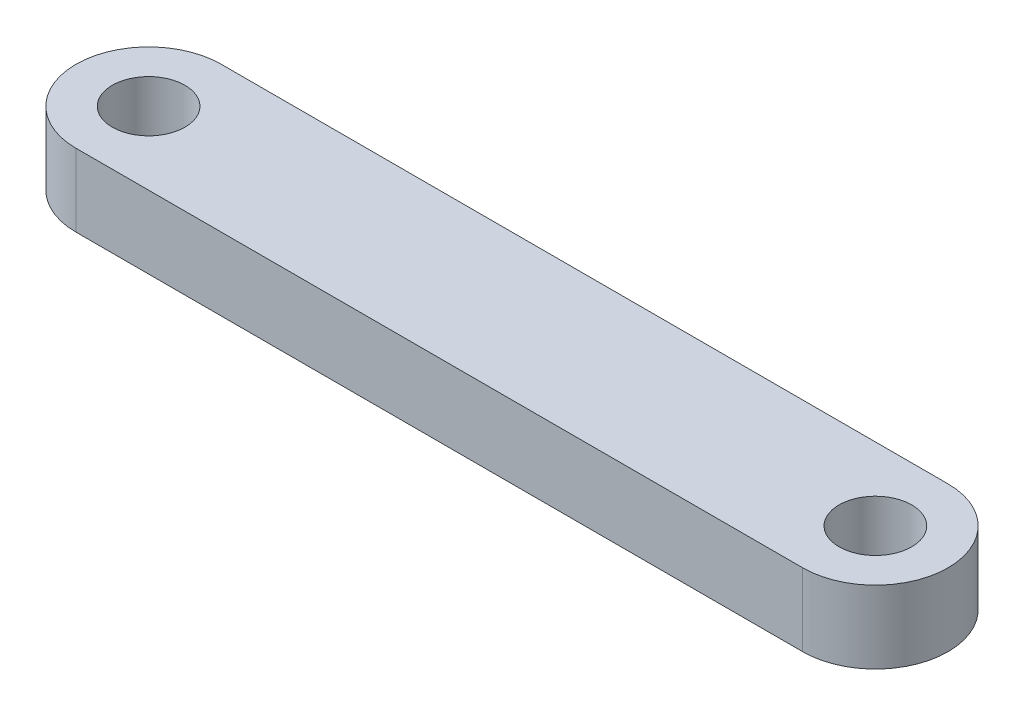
SolidWorks part; units mm, degrees
ref_plane "Front Plane" through (0, 0, 0) normal (0, 0, 1) x (1, 0, 0)
ref_plane "Top Plane" through (0, 0, 0) normal (0, 1, 0) x (1, 0, 0)
ref_plane "Right Plane" through (0, 0, 0) normal (1, 0, 0) x (0, 0, -1)
sketch "Sketch1" plane through (0, 0, 0) normal (0, 1, 0) x (1, 0, 0)
  line L0 (-500, 0) -> (500, 0) construction
  line L1 (-500, 100) -> (500, 100)
  line L2 (-500, -100) -> (500, -100)
  arc A0 (-500, 100) -> (-500, -100) centre (-500, 0) ccw
  arc A1 (500, -100) -> (500, 100) centre (500, 0) ccw
  circle A2 centre (-500, 0) radius 50
  circle A3 centre (500, 0) radius 50
  point P2 (0, 0)
  dimension "D2" = 100
  dimension "D3" = 100
  dimension "D4" = 100
  dimension "D1" = 1000
extrude "Boss-Extrude1" add sketch "Sketch1" along normal mid plane 100
